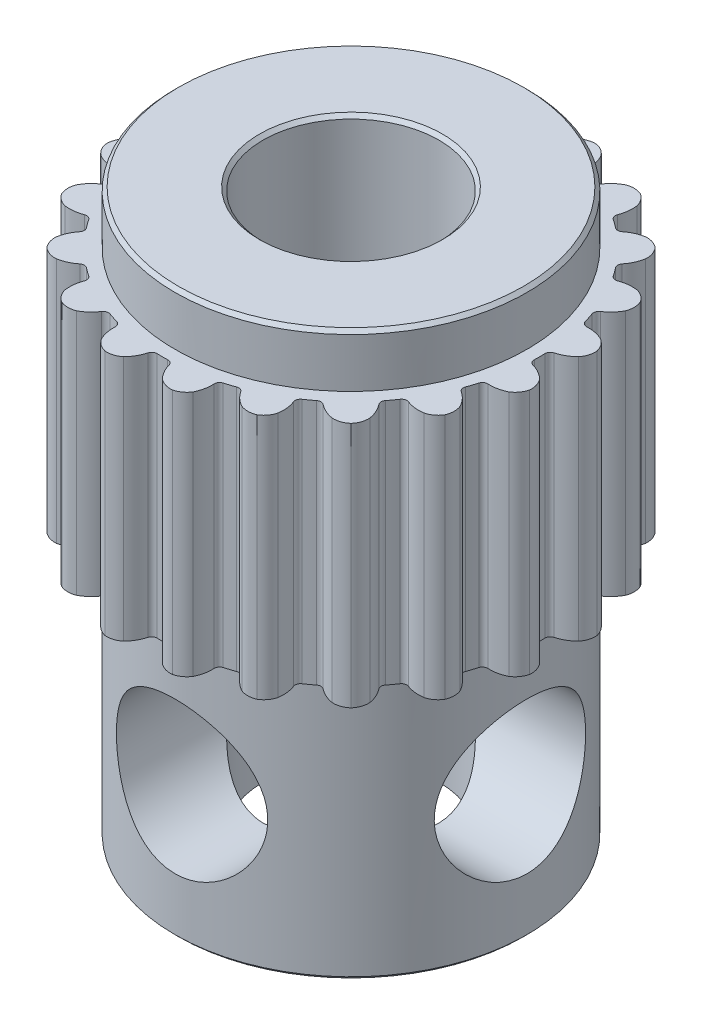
SolidWorks part; units mm, degrees
ref_plane "Front Plane" through (0, 0, 0) normal (0, 0, 1) x (1, 0, 0)
ref_plane "Top Plane" through (0, 0, 0) normal (0, 1, 0) x (1, 0, 0)
ref_plane "Right Plane" through (0, 0, 0) normal (1, 0, 0) x (0, 0, -1)
sketch "BodyS" plane through (0, 0, 0) normal (0, 0, 1) x (1, 0, 0)
  line L0 (6.11, -3.5) -> (6.11, 3.5)
  line L3 (6.11, 3.5) -> (2.5, 3.5)
  line L4 (2.5, 3.5) -> (2.5, -3.5)
  line L9 (2.5, -3.5) -> (6.11, -3.5)
  line L12 (0, 0) -> (6.11, 0) construction
  line L13 (0, 3.5) -> (0, -3.5) construction
  dimension "BoreDia" = 5
  dimension "Height" = 7
  dimension "BeltPathDiaControl" = 3.61
  dimension "RefBeltPathDia" = 12.22
revolve "Body" add sketch "BodyS" angle 360 about L13
sketch "GT2ProfileS" plane through (0, 0, 0) normal (0, 1, 0) x (1, 0, 0)
  line L1 (0, -6.11) -> (0, -5.36) construction
  line L2 (-0.9955, -6.0283) -> (-0.8733, -5.2884) construction
  line L3 (0, 0) -> (-0.8733, -5.2884) construction
  line L4 (0.9955, -6.0283) -> (0, 0) construction
  arc A3 (0.2997, -5.4688) -> (0.1507, -5.3579) centre (0.1549, -5.5078) ccw
  arc A4 (-0.9955, -6.0283) -> (0.9955, -6.0283) centre (0, 0) ccw
  arc A5 (-0.2997, -5.4688) -> (-0.1507, -5.3579) centre (-0.1549, -5.5078) cw
  arc A6 (-0.2997, -5.4688) -> (-0.5497, -5.907) centre (-1.2653, -5.2085) cw
  arc A8 (-0.1507, -5.3579) -> (0.1507, -5.3579) centre (0, 0) ccw
  arc A9 (-0.5497, -5.907) -> (-0.9955, -6.0283) centre (-0.9051, -5.4808) cw
  arc A10 (0.2997, -5.4688) -> (0.5497, -5.907) centre (1.2653, -5.2085) ccw
  arc A11 (0.5497, -5.907) -> (0.9955, -6.0283) centre (0.9051, -5.4808) ccw
  circle A12 centre (0, 0) radius 5.36 construction
  circle A13 centre (0, 0) radius 6.11 construction
extrude "GT2Profile" cut sketch "GT2ProfileS" along direction (0, -1, 0) on the side against the normal up to next (3.5 mm away) and the other way up to next (3.5 mm away)
pattern_circular "GT2 Groove CP" count 20 over 360 about axis through (0, 0, 0) along (0, 1, 0) of "GT2Profile"
sketch "TopWallS" plane through (0, 3.5, 0) normal (0, 1, 0) x (1, 0, 0)
  circle A0 centre (0, 0) radius 2.5 construction
  circle A1 centre (0, 0) radius 2.5
  circle A2 centre (0, 0) radius 5
  dimension "Thickness" = 2.5
extrude "TopWall" add sketch "TopWallS" along normal blind 1.5
sketch "BottomWallS" plane through (0, -3.5, 0) normal (0, -1, 0) x (-1, 0, 0)
  circle A0 centre (0, 0) radius 2.5
  circle A1 centre (0, 0) radius 2.5 construction
  circle A2 centre (0, 0) radius 5
  circle A3 centre (0, 0) radius 5 construction
extrude "BottomWall" add sketch "BottomWallS" along normal blind 7.5
ref_plane "ClearanceHolePlane" through (0, 0, 5) normal (0, 0, 1) x (1, 0, 0)
hole_wizard " Clearance Hole1" positions "Sketch1" profile "Sketch2" hole size "M4" standard "ANSI Metric"
sketch "Sketch1" plane through (0, 0, 5) normal (0, 0, 1) x (1, 0, 0)
  line L0 (0, -11) -> (0, -3.5) construction
  line L1 (-5, -11) -> (5, -11) construction
  line L2 (-0.1507, -3.5) -> (0.1507, -3.5) construction
  point P0 (0, -7.25)
sketch "Sketch2" plane through (0, -7.25, 5) normal (1, 0, 0) x (0, -1, 0)
  line L0 (0, 0) -> (0, 2.5)
  line L1 (0, 2.5) -> (2.15, 2.5)
  line L2 (2.15, 2.5) -> (2.15, 0)
  line L5 (2.15, 0) -> (0, 0)
  line L11 (0, -6.35) -> (0, 107.95) construction
  dimension "Thru Hole Dia." = 4.3
  dimension "Thru Hole Depth" = 2.5
pattern_circular "CirPattern1" count 2 every 90 about axis through (0, -11, 0) along (0, 1, 0) of " Clearance Hole1"
chamfer "InnerC" distance 0.1 angle 45 2 edges at (0, 5, 2.5) (0, -11, -2.5)
chamfer "OuterC" distance 0.1 angle 45 2 edges at (0, -11, -5) (0, 5, 5)
equation "\"D1@GT2 Groove CP\"=int(360/\"ArcLengthAngle@GT2ProfileS\")+1"
